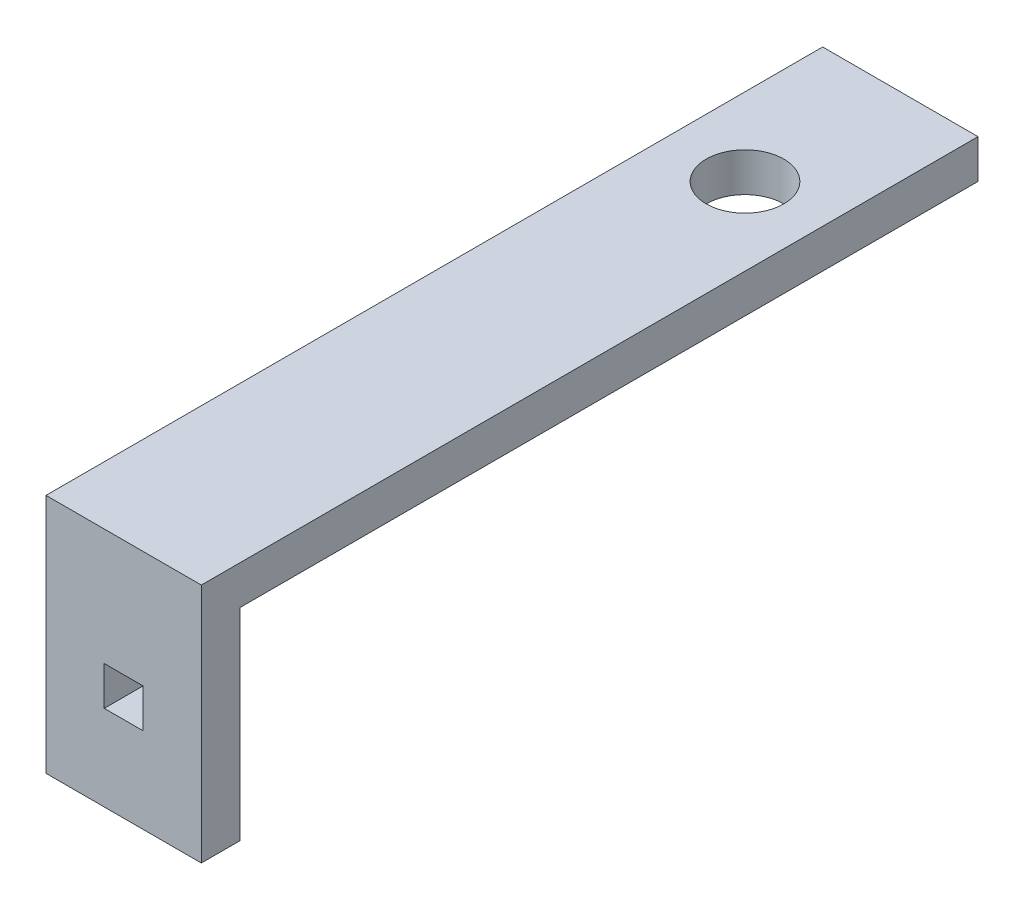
SolidWorks part; units mm, degrees
ref_plane "Front" through (0, 0, 0) normal (0, 0, 1) x (1, 0, 0)
ref_plane "Top" through (0, 0, 0) normal (0, 1, 0) x (1, 0, 0)
ref_plane "Right" through (0, 0, 0) normal (1, 0, 0) x (0, 0, -1)
imported_body "Imported1"
sketch "Sketch1" plane through (0, 0, 29.1608) normal (0, 0, 1) x (1, 0, 0)
  line L0 (-10, -6.6918) -> (-10, -17.6911)
  line L1 (-10, -17.6911) -> (10, -17.6911)
  line L2 (10, -17.6911) -> (10, -6.6918)
  line L3 (10, -6.6918) -> (-10, -6.6918)
extrude "Extrude1" add sketch "Sketch1" against normal up to surface (5 mm away)
